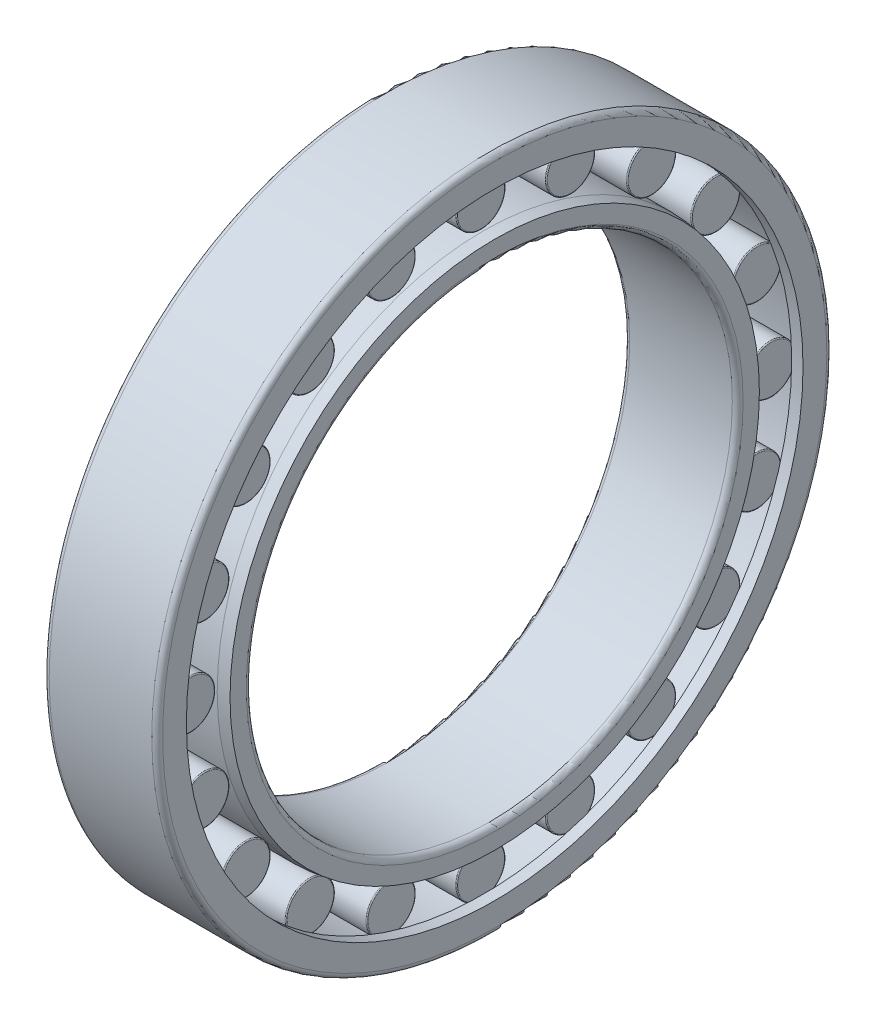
SolidWorks part; units mm, degrees
ref_plane "Plane1" through (0, 0, 0) normal (0, 0, 1) x (1, 0, 0)
ref_plane "Plane2" through (0, 0, 0) normal (0, 1, 0) x (1, 0, 0)
ref_plane "Plane3" through (0, 0, 0) normal (1, 0, 0) x (0, 0, -1)
other "Configuration Table"
sketch "Clipboard" plane through (0, 0, 0) normal (0, 0, 1) x (1, 0, 0)
  line L0 (-10, 0) -> (10, 0) construction
  line L1 (0, 0) -> (185.2698, -67.4327)
  line L2 (0, 0) -> (101.017, 36.7672)
  line L3 (0, 0) -> (218.798, -79.636)
  line L4 (0, 0) -> (-22.3471, -0.7804)
sketch "OutRacSke" plane through (0, 0, 0) normal (0, 0, 1) x (1, 0, 0)
  line L0 (-16.8, 114.1887) -> (-21, 114.1887)
  line L1 (-21, 114.1887) -> (-21, 123)
  line L2 (-19, 125) -> (19, 125)
  line L3 (21, 123) -> (21, 114.1887)
  line L4 (21, 114.1887) -> (16.8, 114.1887)
  line L5 (16.8, 114.1887) -> (16.8, 116.42)
  line L6 (16.8, 116.42) -> (-16.8, 116.42)
  line L7 (-16.8, 116.42) -> (-16.8, 114.1887)
  line L8 (-90, 0) -> (90, 0) construction
  arc A0 (-21, 123) -> (-19, 125) centre (-19, 123) cw
  arc A1 (19, 125) -> (21, 123) centre (19, 123) cw
revolve "OuterRace" add sketch "OutRacSke" angle 360 about L8
sketch "RolDetSke" plane through (0, 0, 0) normal (0, 0, 1) x (1, 0, 0)
  line L0 (-15.96, 116.1851) -> (-15.96, 107.5)
  line L1 (-15.96, 107.5) -> (15.96, 107.5)
  line L2 (15.96, 107.5) -> (15.96, 116.1851)
  line L3 (15.5981, 116.547) -> (-15.5981, 116.547)
  line L4 (-33.6, 107.5) -> (33.6, 107.5) construction
  arc A0 (15.96, 116.1851) -> (15.5981, 116.547) centre (15.5981, 116.1851) ccw
  arc A1 (-15.5981, 116.547) -> (-15.96, 116.1851) centre (-15.5981, 116.1851) ccw
revolve "RollerDetailed" add sketch "RolDetSke" angle 360 about L4
ref_axis "Axis1" through (-50, 0, 0) along (1, 0, 0)
sketch "RolSimSke" plane through (0, 101.6, 0) normal (0, 0, 1) x (1, 0, 0)
  line L0 (-15.96, 14.5851) -> (-15.96, -2.7851)
  line L1 (25.4, -101.6) -> (-25.4, -101.6) construction
  line L2 (15.96, -2.7851) -> (15.96, 14.5851)
  line L3 (15.5981, 14.947) -> (-15.5981, 14.947)
  line L5 (15.5981, -3.147) -> (-15.5981, -3.147)
  arc A0 (15.96, 14.5851) -> (15.5981, 14.947) centre (15.5981, 14.5851) ccw
  arc A1 (-15.5981, 14.947) -> (-15.96, 14.5851) centre (-15.5981, 14.5851) ccw
  arc A2 (15.96, -2.7851) -> (15.5981, -3.147) centre (15.5981, -2.7851) cw
  arc A3 (-15.5981, -3.147) -> (-15.96, -2.7851) centre (-15.5981, -2.7851) cw
revolve "RollersSimplified" [suppressed] add sketch "RolSimSke" angle 360 about L1
sketch "InsRacSke" plane through (0, 0, 0) normal (0, 0, 1) x (1, 0, 0)
  line L0 (-16.8, 98.58) -> (-21, 98.0222)
  line L1 (-21, 98.0222) -> (-21, 92)
  line L2 (-19, 90) -> (19, 90)
  line L3 (21, 92) -> (21, 98.0222)
  line L4 (21, 98.0222) -> (16.8, 98.58)
  line L5 (16.8, 98.58) -> (-16.8, 98.58)
  line L6 (-90, 0) -> (90, 0) construction
  arc A0 (-21, 92) -> (-19, 90) centre (-19, 92) ccw
  arc A1 (19, 90) -> (21, 92) centre (19, 92) ccw
revolve "InnerRace" add sketch "InsRacSke" angle 360 about L6
pattern_circular "RollersDetailed" count 20 every 18 about axis through (-50, 0, 0) along (1, 0, 0) of "RollerDetailed"
sketch "CagSpiSke" plane through (0, 0, 0) normal (0, 0, 1) x (1, 0, 0)
  line L0 (18.9, 105.2383) -> (18.9, 109.7618)
  line L1 (18.9, 109.7618) -> (-18.9, 109.7618)
  line L2 (-18.9, 109.7618) -> (-18.9, 105.2383)
  line L3 (-18.9, 105.2383) -> (18.9, 105.2383)
  line L4 (-90, 0) -> (90, 0) construction
revolve "CageSpine" [suppressed] add sketch "CagSpiSke" angle 360 about L4
equation "\"CLdia@Clipboard\" =  ( \"Race_OD@Clipboard\" + \"Race_ID@Clipboard\" )  / 4"
equation "\"Race_OD@OutRacSke\" = \"Race_OD@Clipboard\""
equation "\"halfCylLen@OutRacSke\" = \"Cyl_Len@OutRacSke\" / 2"
equation "\"RolCLRad@RolDetSke\" = \"CLdia@Clipboard\""
equation "\"Roller_diameter@RolDetSke\" =  ( \"Race_OD@Clipboard\" - \"Race_ID@Clipboard\" )  / 2 + .01"
equation "\"Roller_diameter@RolSimSke\" =  ( \"Race_OD@Clipboard\" - \"Race_ID@Clipboard\" )  / 2 + .01"
equation "\"radius@RolDetSke\" = \"Roller_diameter@RolDetSke\" / 50"
equation "\"Length@RolDetSke\" = \"Cyl_Len@OutRacSke\" * .95"
equation "\"halfLength@RolDetSke\" = \"Length@RolDetSke\" / 2"
equation "\"thickness@CagSpiSke\"  = \"Roller_diameter@RolDetSke\" * .25"
equation "\"Cag_IR@CagSpiSke\" =  \"RolCLRad@RolDetSke\" * 2 - \"thickness@CagSpiSke\""
equation "\"Rol_Length@RolSimSke\" = \"Cyl_Len@InsRacSke\" * .95"
equation "\"halfLength@RolSimSke\" = \"Rol_Length@RolSimSke\" / 2"
equation "\"radius@RolSimSke\" = \"radius@RolDetSke\""
equation "\"D1@RolSimSke\" = \"CLdia@Clipboard\" -  ( \"Roller_diameter@RolSimSke\" / 2 ) "
equation "\"Max_count@Clipboard\" = int( 3.14159265 / atn(( \"Roller_diameter@RolDetSke\" / 2) / sqr( \"RolCLRad@RolDetSke\"  *  \"RolCLRad@RolDetSke\" - ( \"Roller_diameter@RolDetSke\" / 2) *  ( \"Roller_diameter@RolDetS"
equation "\"Max_count@Clipboard\" = ((sgn( \"Max_count@Clipboard\" - \"Count@Clipboard\" )-1)*( \"Max_count@Clipboard\" - \"Count@Clipboard\" ))/-2+ \"Count@Clipboard\""
equation "\"Count@RollersDetailed\" = int( \"Show_count@Clipboard\" ) "
equation "\"Count@RollersDetailed\" = ((sgn( \"Count@RollersDetailed\" - \"Max_count@Clipboard\" )-1)*( \"Count@RollersDetailed\" - \"Max_count@Clipboard\" ))/-2+ \"Max_count@Clipboard\""
equation "\"Count@RollersDetailed\" = ((sgn( \"Count@RollersDetailed\" - \"Min_count@Clipboard\" )+1)*( \"Count@RollersDetailed\" - \"Min_count@Clipboard\"))/2 +\"Min_count@Clipboard\""
equation "\"Angle@RollersDetailed\" = 360.0 / \"Max_count@Clipboard\""
equation "\"radius@InsRacSke\" = \"radius@OutRacSke\""
equation "\"groove_dp@InsRacSke\" = \"groove_dp@OutRacSke\" / 4"
equation "\"Width@InsRacSke\" = \"Width@OutRacSke\""
equation "\"halfWidth@OutRacSke\" = \"Width@OutRacSke\" / 2"
equation "\"halfWidth@InsRacSke\" = \"Width@InsRacSke\" / 2"
equation "\"Race_ID@InsRacSke\" = \"Race_ID@Clipboard\""
equation "\"Cyl_Len@InsRacSke\" = \"Cyl_Len@OutRacSke\""
equation "\"Angle@CageSpine\" =  \"Angle@RollersDetailed\" * ( \"Count@RollersDetailed\" -1 + int( \"Count@RollersDetailed\" / \"Max_count@Clipboard\" ) )  + 0.001 -  int( \"Count@RollersDetailed\" / \"Max_count@Clipboard\" "
equation "\"Angle@CageSpine\" =  \"Angle@CageSpine\" * int( \"Min_count@Clipboard\" / 2) + int(1 / \"Min_count@Clipboard\")  * 0.001"
equation "\"width@CagSpiSke\" =   ( \"Width@InsRacSke\" + \"Cyl_Len@InsRacSke\" )  / 2"
equation "\"halfwidth@CagSpiSke\" = \"width@CagSpiSke\" / 2"
